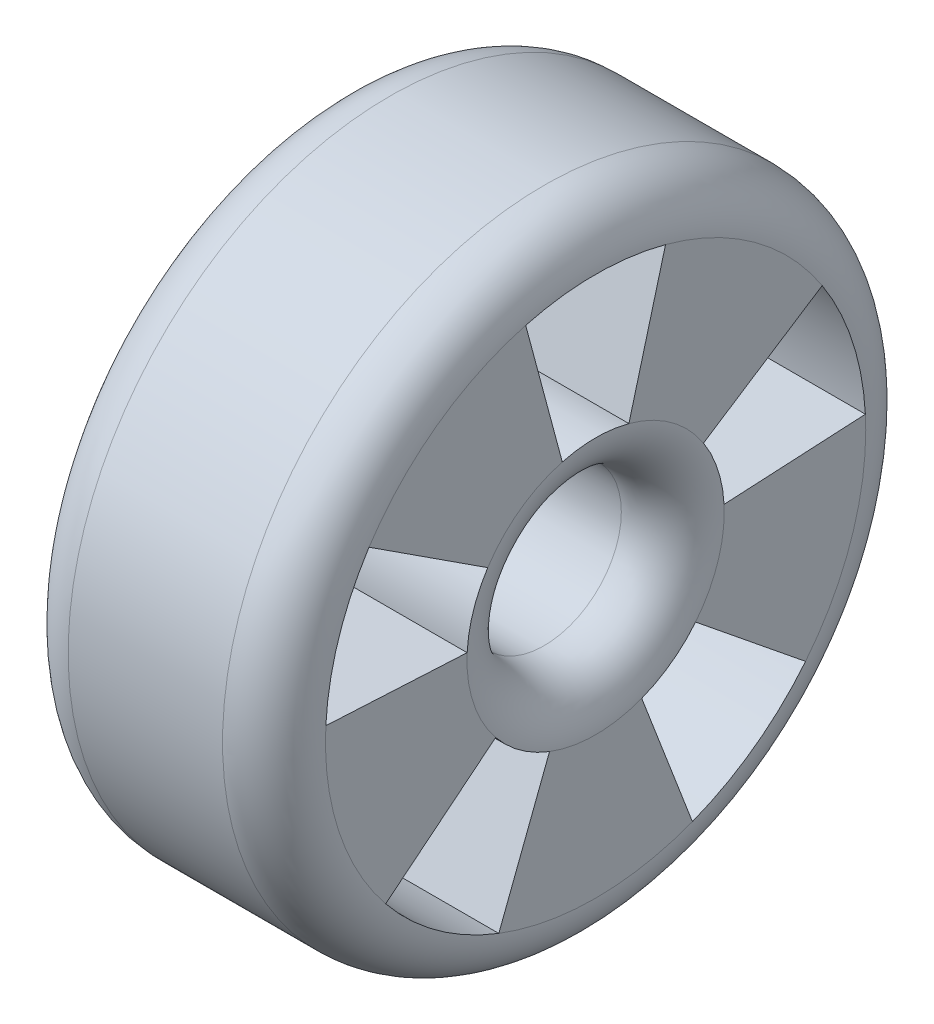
SolidWorks part; units mm, degrees
ref_plane "正面" through (0, 0, 0) normal (0, 0, 1) x (1, 0, 0)
ref_plane "平面" through (0, 0, 0) normal (0, 1, 0) x (1, 0, 0)
ref_plane "右側面" through (0, 0, 0) normal (1, 0, 0) x (0, 0, -1)
sketch "ｽｹｯﾁ1" plane through (0, 0, 0) normal (1, 0, 0) x (0, 0, -1)
  circle A0 centre (0, 0) radius 12.5
  circle A1 centre (0, 0) radius 3
  dimension "D1" = 25
  dimension "D2" = 6
extrude "押し出し1" add sketch "ｽｹｯﾁ1" along normal blind 10
fillet "ﾌｨﾚｯﾄ1" radius 2 4 edges at (0, 0, -12.5) (10, 0, -12.5) (0, 0, -3) (10, 0, -3)
sketch "ｽｹｯﾁ2" plane through (10, 0, 0) normal (1, 0, 0) x (0, 0, -1)
  line L0 (2.7176, 10.1422) -> (1.2941, 4.8296)
  line L1 (0, 0) -> (0, 14.7463) construction
  line L2 (-2.7176, 10.1422) -> (-1.2941, 4.8296)
  line L3 (1.2941, 4.8296) -> (0, 0) construction
  line L4 (0, 0) -> (-1.2941, 4.8296) construction
  arc A0 (2.7176, 10.1422) -> (-2.7176, 10.1422) centre (0, 0) ccw
  arc A1 (1.2941, 4.8296) -> (-1.2941, 4.8296) centre (0, 0) ccw
  dimension "D1" = 21
  dimension "D2" = 10
  dimension "D3" = 30
extrude "ｶｯﾄ - 押し出し1" cut sketch "ｽｹｯﾁ2" against normal through all
pattern_circular "円形ﾊﾟﾀｰﾝ1" count 5 over 360 about axis through (0, 0, 0) along (1, 0, 0) of "ｶｯﾄ - 押し出し1"
